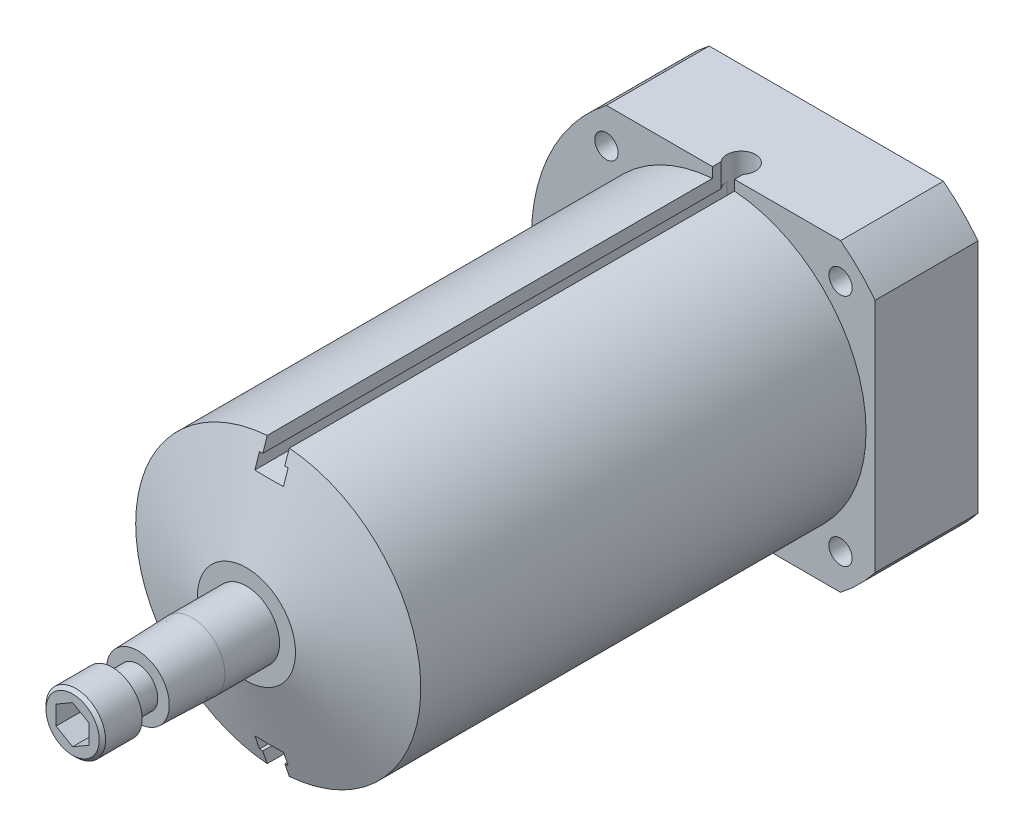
SolidWorks part; units mm, degrees
ref_plane "Front Plane" through (0, 0, 0) normal (0, 0, 1) x (1, 0, 0)
ref_plane "Top Plane" through (0, 0, 0) normal (0, 1, 0) x (1, 0, 0)
ref_plane "Right Plane" through (0, 0, 0) normal (1, 0, 0) x (0, 0, -1)
sketch "Sketch1" plane through (0, 0, 0) normal (0, 0, 1) x (1, 0, 0)
  line L0 (0, 0) -> (62.0084, 0) construction
  line L1 (-28.0574, 36.4998) -> (28.0574, 36.4998)
  line L2 (36.3474, 28.2545) -> (36.3474, -28.2545)
  line L3 (-28.0574, -36.4998) -> (28.0574, -36.4998)
  arc A0 (-28.0574, 36.4998) -> (-28.0574, -36.4998) centre (0, 0) ccw
  arc A1 (36.3474, 28.2545) -> (28.0574, 36.4998) centre (0, 0) ccw
  arc A2 (28.0574, -36.4998) -> (36.3474, -28.2545) centre (0, 0) ccw
  dimension "D1" = 92.075
  dimension "D2" = 72.9996
  dimension "D3" = 36.3474
extrude "Extrude1" add sketch "Sketch1" along normal blind 138.938
sketch "Sketch2" plane through (0, 0, 0) normal (0, 1, 0) x (1, 0, 0)
  line L0 (0, 0) -> (0, -96.9332) construction
  line L1 (-46.0375, -24.638) -> (-34.163, -24.638)
  line L2 (-46.0375, 0) -> (-46.0375, -138.938) construction
  line L3 (-34.163, -24.638) -> (-34.163, -131.318)
  line L4 (-34.163, -131.318) -> (-11.7475, -138.938)
  line L7 (-11.7475, -138.938) -> (-46.0375, -138.938)
  line L8 (-46.0375, -138.938) -> (-46.0375, -24.638)
  dimension "D1" = 114.3
  dimension "D2" = 68.326
  dimension "D3" = 23.495
  dimension "D4" = 7.62
revolve "Cut-Revolve1" cut sketch "Sketch2" angle 360 about L0
sketch "Sketch4" plane through (0, 0, 0) normal (0, 1, 0) x (1, 0, 0)
  line L0 (0, 0) -> (0, -99.9671) construction
  line L1 (-7.9311, -138.938) -> (-7.9311, -152.019)
  line L2 (-11.7475, -138.938) -> (11.7475, -138.938) construction
  line L3 (-7.9311, -152.019) -> (-7.5247, -164.9509)
  line L4 (-7.5247, -164.9509) -> (0, -164.9509)
  line L7 (0, -164.9509) -> (0, -138.938)
  line L8 (0, -138.938) -> (-7.9311, -138.938)
  line L10 (-28.0574, 0) -> (-46.0375, 0) construction
  dimension "D1" = 1.8
  dimension "D4" = 15.8623
  dimension "D5" = 15.0495
  dimension "D6" = 12.9319
  dimension "D7" = 152.019
revolve "Revolve1" add sketch "Sketch4" angle 360 about L0
hole_wizard "Hole1" positions "Sketch6" profile "Sketch5" legacy
sketch "Sketch6" plane through (0, 0, 164.9509) normal (0, 0, 1) x (1, 0, 0)
  circle A0 centre (0, 0) radius 7.5247 construction
  point P0 (0, 0)
sketch "Sketch5" plane through (0, 0, 164.9509) normal (1, 0, 0) x (0, -1, 0)
  line L0 (0, 0) -> (0, 21.5835)
  line L1 (0, 21.5835) -> (4.2164, 19.05)
  line L2 (4.2164, 19.05) -> (4.2164, 0)
  line L4 (4.2164, 0) -> (0, 0)
  line L6 (0, 21.5835) -> (-4.2164, 19.05) construction
  line L7 (0, -4.2442) -> (0, 117.3081) construction
  dimension "Diameter" = 8.4328
  dimension "Depth" = 19.05
  dimension "Drill Angle" = 118
hole_wizard "Hole2" positions "Sketch10" profile "Sketch9" legacy
sketch "Sketch10" plane through (0, 0, 24.638) normal (0, 0, 1) x (1, 0, 0)
  line L1 (0, 0) -> (19.5659, 0) construction
  line L2 (0, 0) -> (28.0453, 28.0453) construction
  circle A0 centre (0, 0) radius 39.6621 construction
  point P0 (28.0453, 28.0453)
  dimension "D2" = 79.3242
  dimension "D1" = 45
sketch "Sketch9" plane through (28.0453, 28.0453, 24.638) normal (1, 0, 0) x (0, -1, 0)
  line L0 (0, 0) -> (0, 24.639)
  line L1 (0, 24.639) -> (2.794, 24.639)
  line L2 (2.794, 24.639) -> (2.794, 0)
  line L3 (2.794, 0) -> (0, 0)
  line L4 (0, 110) -> (0, -10) construction
  dimension "Diameter" = 5.588
  dimension "Depth" = 24.639
pattern_circular "CirPattern1" count 4 over 360 about axis through (0, 0, 0) along (0, 0, 1) of "Hole2"
ref_plane "Plane1" through (0, 0, 15.7988) normal (0, 0, -1) x (-1, 0, 0)
sketch "Sketch11" plane through (0, 0, 15.7988) normal (0, 0, -1) x (-1, 0, 0)
  line L0 (0, 0) -> (24.6663, 11.5021) construction
  line L1 (0, 0) -> (27.0444, 0) construction
  line L2 (75.645, 39.8701) -> (29.6046, 18.4011)
  line L3 (29.6046, 18.4011) -> (31.365, 14.6258)
  line L4 (31.365, 14.6258) -> (77.4055, 36.0948)
  line L5 (77.4055, 36.0948) -> (75.645, 39.8701)
  dimension "D1" = 25
  dimension "D2" = 34.6075
  dimension "D3" = 8.3312
  dimension "D4" = 50.8
revolve "Cut-Revolve2" cut sketch "Sketch11" angle 360 about L0
mirror "Mirror1" about plane through (0, 0, 0) normal (0, 1, 0) of "Cut-Revolve2"
sketch "Sketch12" plane through (0, 0, 138.938) normal (0, 0, 1) x (1, 0, 0)
  line L0 (0, 0) -> (0, 26.7352) construction
  line L1 (-2.6416, 50.8) -> (-2.6416, 30.8737)
  line L2 (-2.6416, 30.8737) -> (-3.429, 30.8737)
  line L3 (-3.429, 30.8737) -> (-3.429, 27.5717)
  line L4 (-3.429, 27.5717) -> (3.429, 27.5717)
  line L5 (3.429, 30.8737) -> (3.429, 27.5717)
  line L6 (2.6416, 30.8737) -> (3.429, 30.8737)
  line L7 (2.6416, 50.8) -> (2.6416, 30.8737)
  line L8 (-2.6416, 50.8) -> (2.6416, 50.8)
  dimension "D1" = 5.2832
  dimension "D2" = 6.858
  dimension "D3" = 3.302
  dimension "D4" = 27.5717
  dimension "D5" = 50.8
extrude "Cut-Extrude1" cut sketch "Sketch12" against normal blind 118.5418
sketch "Sketch13" plane through (0, 0, 138.938) normal (0, 0, 1) x (1, 0, 0)
  line L0 (0, 0) -> (32.0428, 0) construction
  line L1 (0, 0) -> (0, -27.5102) construction
  line L2 (-3.429, -27.5717) -> (3.429, -27.5717)
  line L3 (3.429, -27.5717) -> (3.429, -30.8737)
  line L4 (3.429, -30.8737) -> (2.6416, -30.8737)
  line L5 (2.6416, -30.8737) -> (2.6416, -50.8)
  line L6 (2.6416, -50.8) -> (-2.6416, -50.8)
  line L7 (-3.429, 27.5717) -> (3.429, 27.5717) construction
  line L8 (3.429, 30.8737) -> (3.429, 27.5717) construction
  line L9 (2.6416, 50.8) -> (2.6416, 30.8737) construction
  line L10 (-2.6416, -30.8737) -> (-2.6416, -50.8)
  line L11 (-3.429, -30.8737) -> (-2.6416, -30.8737)
  line L12 (-3.429, -27.5717) -> (-3.429, -30.8737)
extrude "Cut-Extrude2" cut sketch "Sketch13" against normal blind 98.425
sketch "Sketch14" plane through (0, 36.4998, 0) normal (0, 1, 0) x (1, 0, 0)
  line L0 (-2.6416, -20.3962) -> (2.6416, -20.3962) construction
  circle A0 centre (0, -20.3962) radius 3.429
  dimension "D1" = 3.429
extrude "Cut-Extrude3" cut sketch "Sketch14" against normal up to surface (8.9281 mm away)
sketch "Sketch15" plane through (0, -36.4998, 0) normal (0, -1, 0) x (1, 0, 0)
  line L0 (3.429, 40.513) -> (-3.429, 40.513) construction
  circle A0 centre (0, 40.513) radius 3.429
  dimension "D1" = 3.429
extrude "Cut-Extrude4" cut sketch "Sketch15" against normal up to surface (8.9281 mm away)
sketch "Sketch16" plane through (0, 0, 0) normal (0, 1, 0) x (1, 0, 0)
  line L0 (0, 0) -> (0, -122.9241) construction
  line L1 (-4.7625, -164.9509) -> (-4.7625, -171.069)
  line L2 (-7.5247, -164.9509) -> (7.5247, -164.9509) construction
  line L3 (-4.7625, -171.069) -> (-7.1374, -171.069)
  line L4 (-7.1374, -171.069) -> (-7.1374, -179.832)
  line L5 (-7.1374, -179.832) -> (-6.3754, -180.594)
  line L6 (-6.3754, -180.594) -> (0, -180.594)
  line L7 (0, -180.594) -> (0, -164.9509)
  line L8 (0, -164.9509) -> (-4.7625, -164.9509)
  line L9 (-7.9311, -152.019) -> (7.9311, -152.019) construction
  dimension "D1" = 9.525
  dimension "D2" = 19.05
  dimension "D3" = 14.2748
  dimension "D4" = 9.525
  dimension "D5" = 45
  dimension "D6" = 12.7508
revolve "Revolve2" add sketch "Sketch16" angle 360 about L0
sketch "Sketch17" plane through (0, 0, 180.594) normal (0, 0, 1) x (1, 0, 0)
  line L1 (3.9624, -2.2877) -> (3.9624, 2.2877)
  line L2 (3.9624, 2.2877) -> (0, 4.5754)
  line L3 (0, 4.5754) -> (-3.9624, 2.2877)
  line L4 (-3.9624, 2.2877) -> (-3.9624, -2.2877)
  line L5 (-3.9624, -2.2877) -> (0, -4.5754)
  line L6 (0, -4.5754) -> (3.9624, -2.2877)
  circle A0 centre (0, 0) radius 3.9624 construction
  dimension "D1" = 7.9248
extrude "Cut-Extrude5" cut sketch "Sketch17" against normal blind 6.35
